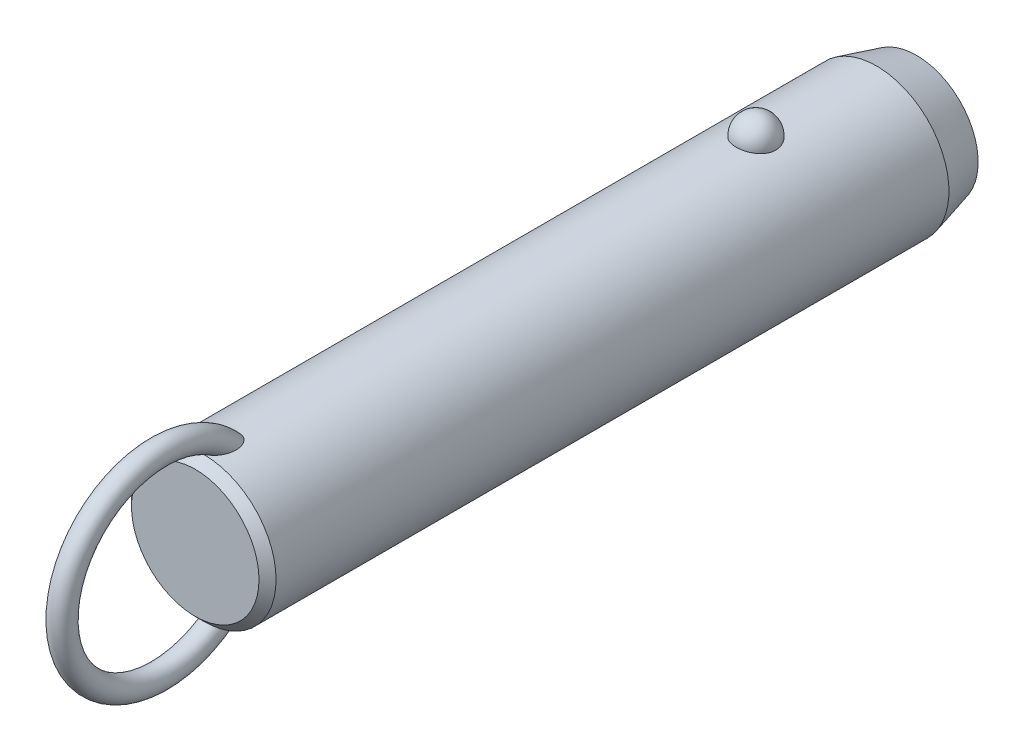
SolidWorks part; units mm, degrees
ref_plane "Front Plane" through (0, 0, 0) normal (0, 0, 1) x (1, 0, 0)
ref_plane "Top Plane" through (0, 0, 0) normal (0, 1, 0) x (1, 0, 0)
ref_plane "Right Plane" through (0, 0, 0) normal (1, 0, 0) x (0, 0, -1)
sketch "Sketch2" plane through (0, 0, 0) normal (0, 0, 1) x (1, 0, 0)
  circle A0 centre (0, 0) radius 12.7
  point P3 (0, 12.7)
  dimension "D1" = 25.4
extrude "Boss-Extrude1" add sketch "Sketch2" along normal blind 82.3
sketch "Sketch3" plane through (0, 0, 0) normal (0, 0, -1) x (-1, 0, 0)
  circle A0 centre (0, 0) radius 12.7
  dimension "D1" = 25.4
extrude "Boss-Extrude2" add sketch "Sketch3" along normal blind 31.7
chamfer "Chamfer1" distance 7 angle 15 1 edges at (-12.7, 0, -31.7)
sketch "Sketch12" plane through (0, 0, 0) normal (1, 0, 0) x (0, 0, -1)
  line L0 (-82.3, 12.7) -> (-82.3, -12.7) construction
  point P0 (-82.3, 0)
sketch "Sketch13" plane through (0, 0, 0) normal (1, 0, 0) x (0, 0, -1)
  circle A0 centre (-101.35, 0) radius 19.05
  point P2 (-82.3, 0)
  dimension "D1" = 38.1
sketch "Sketch14" plane through (0, 0, 0) normal (0, 1, 0) x (1, 0, 0)
  circle A0 centre (0, -84.3) radius 2
  point P2 (0, -82.3)
  dimension "D1" = 4
sweep "Sweep1" add profiles "Sketch14" path "Sketch13"
sketch "Sketch15" plane through (0, 0, 82.3) normal (0, 0, 1) x (1, 0, 0)
  circle A0 centre (0, 0) radius 12.7
  dimension "D1" = 25.4
extrude "Boss-Extrude3" add sketch "Sketch15" along normal blind 12.7
chamfer "Chamfer2" distance 1.5 angle 45 1 edges at (12.7, 0, 95)
sketch "Sketch18" plane through (0, 0, 0) normal (1, 0, 0) x (0, 0, -1)
  line L0 (24.7, 12.7) -> (-87.151, 12.7) construction
  line L1 (3.5, 16.2) -> (3.5, 9.2)
  line L2 (-87.151, -12.7) -> (24.7, -12.7) construction
  arc A0 (3.5, 16.2) -> (3.5, 9.2) centre (3.5, 12.7) ccw
  point P4 (0, 12.7)
  dimension "D1" = 28.9
revolve "Revolve1" add sketch "Sketch18" angle 360 about L1
